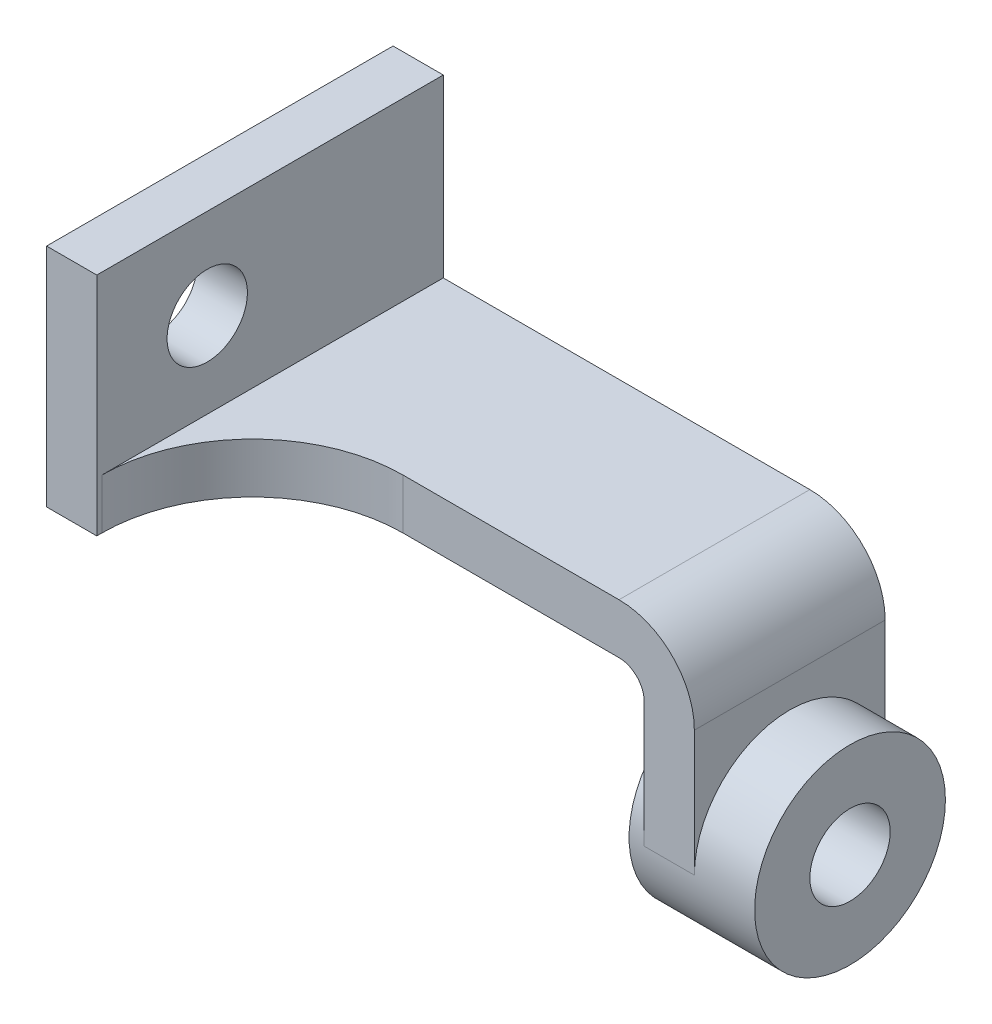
SolidWorks part; units mm, degrees
ref_plane "Plane1" through (0, 0, 0) normal (0, 0, 1) x (1, 0, 0)
ref_plane "Plane2" through (0, 0, 0) normal (0, 1, 0) x (1, 0, 0)
ref_plane "Plane3" through (0, 0, 0) normal (1, 0, 0) x (0, 0, -1)
sketch "Sketch1" plane through (0, 0, 0) normal (1, 0, 0) x (0, 0, -1)
  line L1 (-50, -22.5) -> (19, -22.5)
  line L2 (-50, -22.5) -> (-50, 22.5)
  line L3 (-50, 22.5) -> (19, 22.5)
  line L4 (19, -22.5) -> (19, 22.5)
  dimension "D1" = 69
  dimension "D2" = 45
  dimension "D3" = 19
  dimension "D4" = 22.5
extrude "Base-Extrude" add sketch "Sketch1" along normal blind 10
sketch "Sketch2" plane through (0, 0, 0) normal (0, 0, 1) x (1, 0, 0)
  line L0 (10, 22.5) -> (10, -22.5) construction
  line L1 (10, -12.5) -> (10, -22.5)
  line L2 (10, -22.5) -> (88, -22.5)
  line L3 (88, -22.5) -> (88, -52.5)
  line L4 (10, 22.5) -> (0, 22.5) construction
  line L5 (10, -12.5) -> (98, -12.5)
  line L6 (98, -12.5) -> (98, -52.5)
  line L7 (98, -52.5) -> (88, -52.5)
  dimension "D1" = 75
  dimension "D2" = 78
  dimension "D3" = 10
  dimension "D4" = 10
extrude "Boss-Extrude1" add sketch "Sketch2" along normal mid plane 38
fillet "Fillet1" radius 30 2 edges
sketch "Sketch3" plane through (98, 0, 0) normal (1, 0, 0) x (0, 0, -1)
  line L0 (-19, -52.5) -> (19, -52.5) construction
  circle A0 centre (0, -52.5) radius 19
  dimension "D1" = 38
extrude "Boss-Extrude2" add sketch "Sketch3" along normal blind 12 and the other way blind 13
sketch "Sketch4" plane through (110, 0, 0) normal (1, 0, 0) x (0, 0, -1)
  circle A0 centre (0, -52.5) radius 8
  circle A1 centre (0, -52.5) radius 19 construction
  dimension "D1" = 16
extrude "Cut-Extrude1" cut sketch "Sketch4" against normal through all
sketch "Sketch5" plane through (10, 0, 0) normal (1, 0, 0) x (0, 0, -1)
  line L0 (-50, 22.5) -> (-50, -22.5) construction
  line L1 (19, 22.5) -> (-50, 22.5) construction
  circle A0 centre (-28, 4.5) radius 8
  dimension "D3" = 16
  dimension "D1" = 22
  dimension "D2" = 18
extrude "Cut-Extrude2" cut sketch "Sketch5" against normal through all
fillet "Fillet4" radius 15 2 edges at (98, -12.5, 0)
fillet "Fillet5" radius 5 1 edges at (88, -22.5, 0)
sketch "Sketch6" plane through (0, 0, 0) normal (0, 0, 1) x (1, 0, 0)
  line L0 (30, -2.5) -> (83, -2.5)
  line L1 (10, 22.5) -> (10, -22.5) construction
  line L2 (108, -27.5) -> (108, -33.5)
  line L3 (10, 22.5) -> (10, 17.5)
  line L4 (110, -33.5) -> (98, -33.5) construction
  line L5 (40, -12.5) -> (10, -12.5) construction
  line L6 (98, -52.5) -> (98, -27.5) construction
  arc A0 (108, -27.5) -> (83, -2.5) centre (83, -27.5) ccw
  arc A1 (30, -2.5) -> (10, 17.5) centre (30, 17.5) cw
  dimension "D3" = 25
  dimension "D4" = 20
  dimension "D1" = 10
  dimension "D2" = 10
